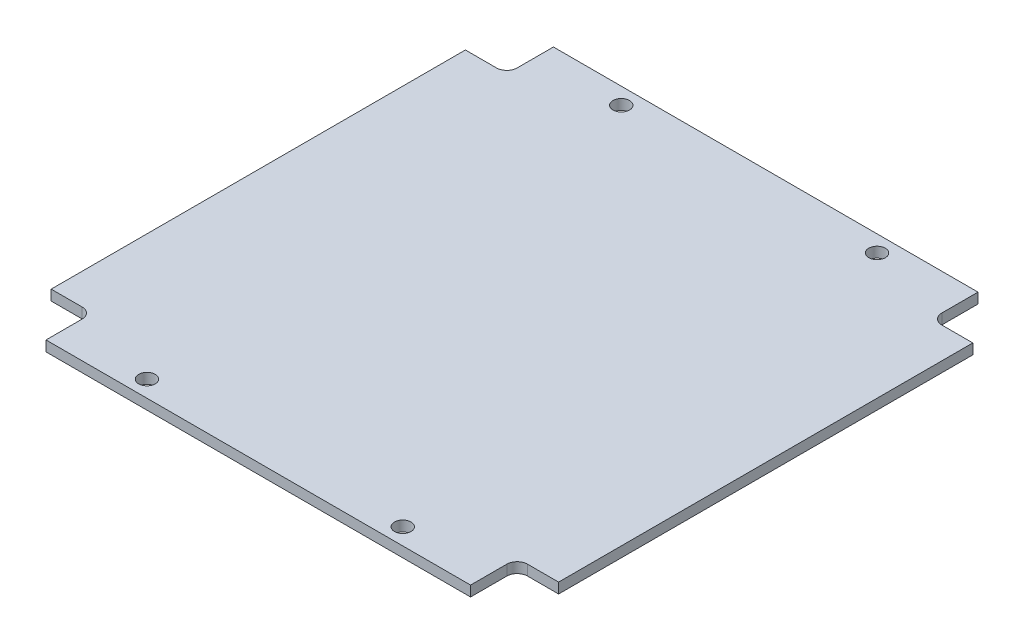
SolidWorks part; units mm, degrees
ref_plane "Front Plane" through (0, 0, 0) normal (0, 0, 1) x (1, 0, 0)
ref_plane "Top Plane" through (0, 0, 0) normal (0, 1, 0) x (1, 0, 0)
ref_plane "Right Plane" through (0, 0, 0) normal (1, 0, 0) x (0, 0, -1)
sketch "Sketch1" plane through (0, 0, 0) normal (0, 1, 0) x (1, 0, 0)
  line L0 (-49, 40) -> (-49, -40)
  line L1 (-49, -40) -> (-43, -40)
  line L2 (-41, -42) -> (-41, -49)
  line L3 (-41, -49) -> (41, -49)
  line L4 (41, -49) -> (41, -42)
  line L5 (43, -40) -> (49, -40)
  line L6 (49, -40) -> (49, 40)
  line L7 (49, 40) -> (43, 40)
  line L8 (41, 42) -> (41, 49)
  line L9 (41, 49) -> (-41, 49)
  line L10 (-41, 49) -> (-41, 42)
  line L11 (-43, 40) -> (-49, 40)
  arc A0 (-41, 42) -> (-43, 40) centre (-43, 42) cw
  arc A1 (43, 40) -> (41, 42) centre (43, 42) cw
  arc A2 (41, -42) -> (43, -40) centre (43, -42) cw
  arc A3 (-43, -40) -> (-41, -42) centre (-43, -42) cw
  point P15 (-41, 40)
  point P18 (41, 40)
  point P21 (41, -40)
  point P24 (-41, -40)
  dimension "D13" = 2
  dimension "D1" = 98
  dimension "D2" = 98
  dimension "D3" = 49
  dimension "D4" = 49
  dimension "D5" = 9
  dimension "D6" = 8
  dimension "D7" = 9
  dimension "D8" = 8
  dimension "D9" = 9
  dimension "D10" = 8
  dimension "D11" = 8
  dimension "D12" = 9
extrude "Boss-Extrude1" add sketch "Sketch1" along normal blind 2
hole_wizard "Ø3.2 (3.2) Diameter Hole1" positions "Sketch3" profile "Sketch2" hole size "Ø3.2" standard "ISO"
sketch "Sketch3" plane through (0, 2, 0) normal (0, 1, 0) x (1, 0, 0)
  line L0 (41, 49) -> (-41, 49) construction
  line L1 (-41, 49) -> (-41, 42) construction
  line L2 (41, 42) -> (41, 49) construction
  line L3 (-41, -49) -> (41, -49) construction
  line L4 (-41, -42) -> (-41, -49) construction
  line L5 (41, -49) -> (41, -42) construction
  point P0 (24.7, 45.8)
  point P2 (-24.7, 45.8)
  point P4 (-24.7, -45.8)
  point P6 (24.7, -45.8)
  dimension "D1" = 3.2
  dimension "D2" = 16.3
  dimension "D3" = 16.3
  dimension "D4" = 3.2
  dimension "D5" = 16.3
  dimension "D6" = 16.3
sketch "Sketch2" plane through (24.7, 2, -45.8) normal (1, 0, 0) x (0, 0, 1)
  line L0 (0, 0) -> (0, 2)
  line L1 (0, 2) -> (1.6, 2)
  line L2 (1.6, 2) -> (1.6, 0)
  line L5 (1.6, 0) -> (0, 0)
  line L11 (0, -6.35) -> (0, 107.95) construction
  dimension "Thru Hole Dia." = 3.2
  dimension "Thru Hole Depth" = 2
